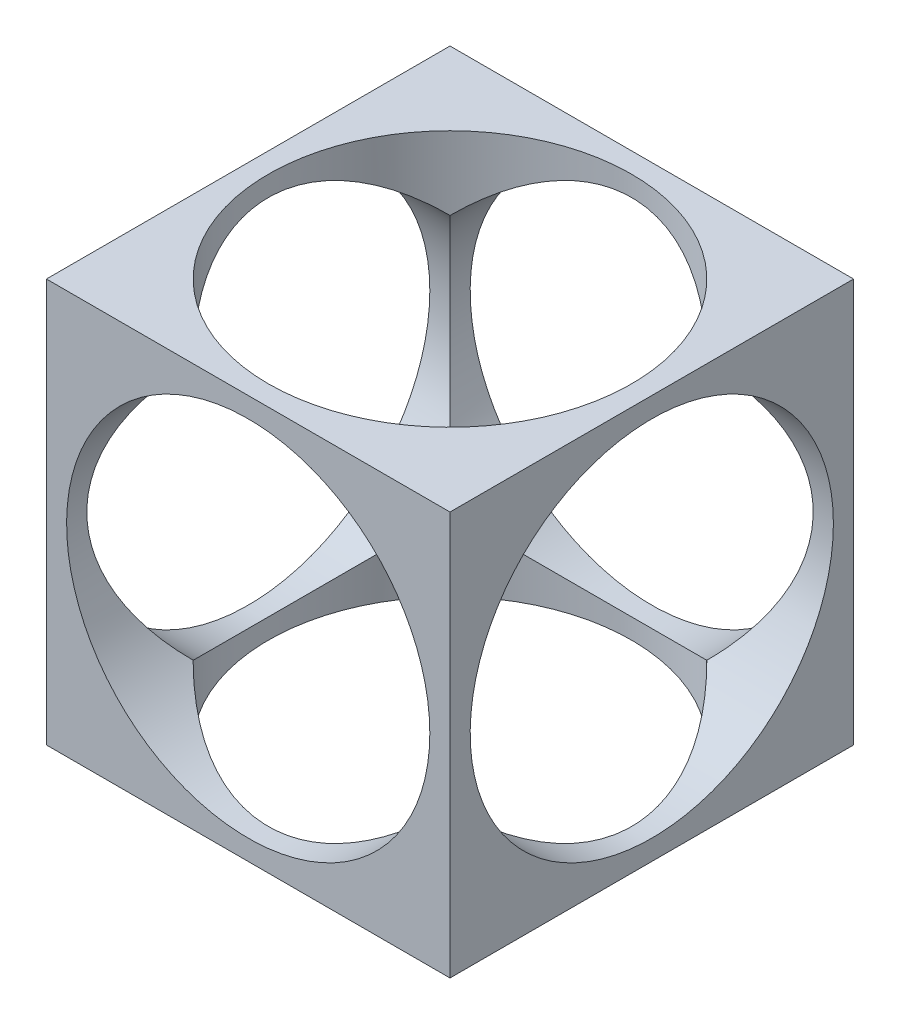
SolidWorks part; units mm, degrees
ref_plane "Front" through (0, 0, 0) normal (0, 0, 1) x (1, 0, 0)
ref_plane "Top" through (0, 0, 0) normal (0, 1, 0) x (1, 0, 0)
ref_plane "Right" through (0, 0, 0) normal (1, 0, 0) x (0, 0, -1)
sketch "Sketch1" plane through (0, 0, 0) normal (0, 0, 1) x (1, 0, 0)
  line L1 (0, 0) -> (100, 0)
  line L2 (0, 0) -> (0, 100)
  line L3 (0, 100) -> (100, 100)
  line L4 (100, 0) -> (100, 100)
  dimension "D1" = 100
  dimension "D2" = 100
extrude "Extrude1" add sketch "Sketch1" along normal blind 100
sketch "Sketch2" plane through (0, 0, 0) normal (1, 0, 0) x (0, 0, -1)
  circle A0 centre (-50, 50) radius 45
  dimension "D2" = 50
  dimension "D3" = 90
  dimension "D1" = 50
extrude "Cut-Extrude1" cut sketch "Sketch2" along normal through all
sketch "Sketch4" plane through (100, 0, 0) normal (0, 0, 1) x (1, 0, 0)
  circle A0 centre (-50, 50) radius 45
  dimension "D2" = 50
  dimension "D1" = 50
extrude "Cut-Extrude2" cut sketch "Sketch4" along normal through all
sketch "Sketch5" plane through (100, 0, 0) normal (0, 1, 0) x (0, 0, -1)
  circle A0 centre (-50, 50) radius 45
  dimension "D2" = 50
  dimension "D1" = 50
extrude "Cut-Extrude3" cut sketch "Sketch5" along normal through all
